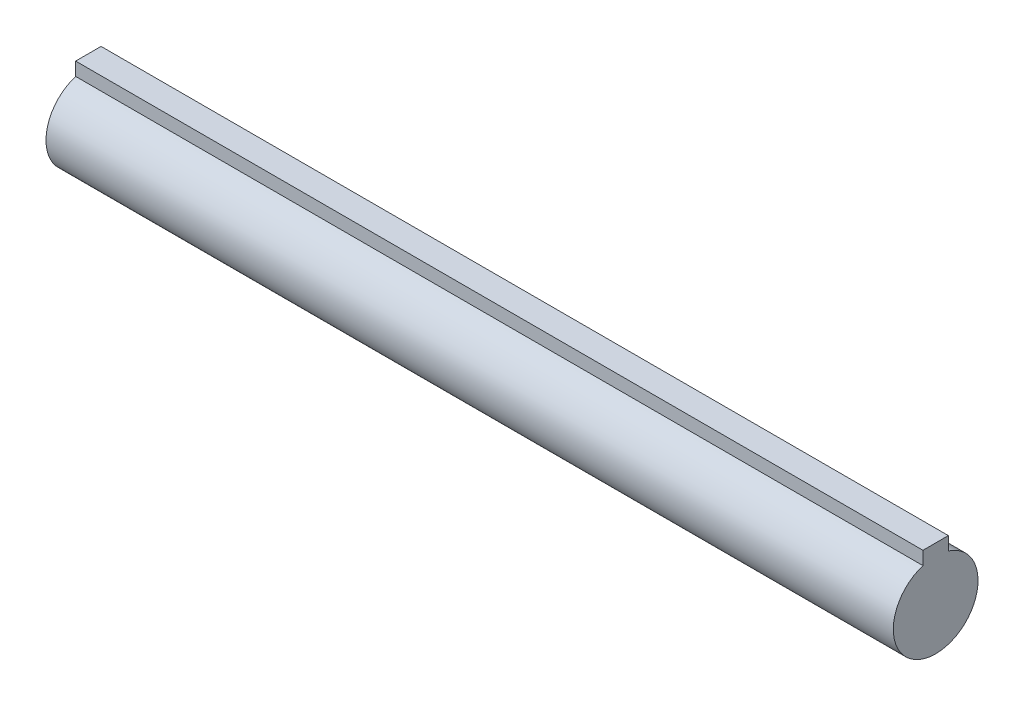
SolidWorks part; units mm, degrees
ref_plane "Plan de face" through (0, 0, 0) normal (0, 0, 1) x (1, 0, 0)
ref_plane "Plan de dessus" through (0, 0, 0) normal (0, 1, 0) x (1, 0, 0)
ref_plane "Plan de droite" through (0, 0, 0) normal (1, 0, 0) x (0, 0, -1)
sketch "Esquisse1" plane through (0, 0, 0) normal (0, 0, 1) x (1, 0, 0)
  line L0 (83.3734, 0) -> (-117.2513, 0) construction
  line L1 (0, 0) -> (-200, 0)
  line L2 (0, 0) -> (0, 10)
  line L3 (0, 10) -> (-200, 10)
  line L4 (-200, 0) -> (-200, 10)
  dimension "D1" = 20
  dimension "D2" = 200
revolve "Révolution1" add sketch "Esquisse1" angle 360 about L0
sketch "Esquisse2" plane through (0, 0, 0) normal (1, 0, 0) x (0, 0, -1)
  line L1 (-3, 12.68) -> (3, 12.68)
  line L2 (-3, 12.68) -> (-3, 7.4272)
  line L3 (-3, 7.4272) -> (3, 7.4272)
  line L4 (3, 12.68) -> (3, 7.4272)
  dimension "D1" = 6
  dimension "D2" = 12.68
  dimension "D3" = 3
extrude "Extrusion1" add sketch "Esquisse2" against normal blind 200
